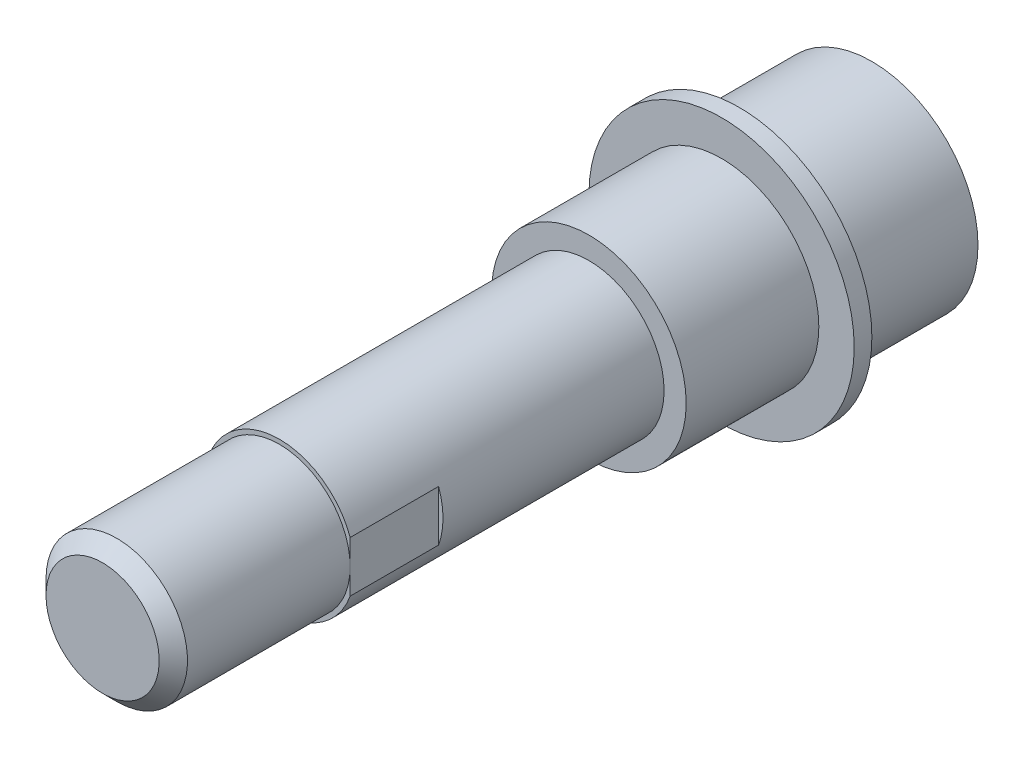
SolidWorks part; units mm, degrees
ref_plane "Plan de face" through (0, 0, 0) normal (0, 0, 1) x (1, 0, 0)
ref_plane "Plan de dessus" through (0, 0, 0) normal (0, 1, 0) x (1, 0, 0)
ref_plane "Plan de droite" through (0, 0, 0) normal (1, 0, 0) x (0, 0, -1)
sketch "Esquisse1" plane through (0, 0, 0) normal (1, 0, 0) x (0, 0, -1)
  line L0 (0, 0) -> (0, 8)
  line L1 (0, 8) -> (20, 8)
  line L2 (20, 8) -> (20, 8.5)
  line L3 (20, 8.5) -> (55, 8.5)
  line L4 (55, 8.5) -> (55, 11)
  line L5 (55, 11) -> (70, 11)
  line L6 (70, 11) -> (70, 15)
  line L7 (70, 15) -> (72, 15)
  line L8 (72, 15) -> (72, 12)
  line L9 (72, 12) -> (87, 12)
  line L10 (87, 12) -> (87, 0)
  line L11 (0, 0) -> (87, 0) construction
  line L12 (0, 0) -> (87, 0)
  dimension "D1" = 16
  dimension "D2" = 20
  dimension "D3" = 17
  dimension "D4" = 22
  dimension "D5" = 24
  dimension "D6" = 30
  dimension "D7" = 55
  dimension "D8" = 87
  dimension "D9" = 2
  dimension "D10" = 15
revolve "Révolution1" add sketch "Esquisse1" angle 360 about L11
chamfer "Chanfrein1" distance 1.6 angle 45 1 edges at (8, 0, 0)
sketch "Esquisse2" plane through (0, 0, -20) normal (0, 0, 1) x (1, 0, 0)
  line L0 (8, 2.8723) -> (8, -2.8723)
  arc A0 (8, -2.8723) -> (8, 2.8723) centre (0, 0) ccw
  circle A1 centre (0, 0) radius 8.5 construction
  circle A2 centre (0, 0) radius 8 construction
extrude "Extrusion1" cut sketch "Esquisse2" against normal blind 10
mirror "Symétrie1" about plane through (0, 0, 0) normal (1, 0, 0) of "Extrusion1"
